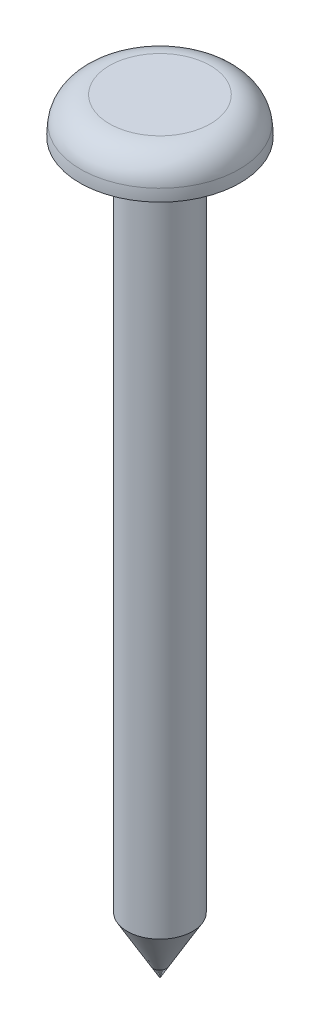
SolidWorks part; units mm, degrees
ref_plane "Plan de face" through (0, 0, 0) normal (0, 0, 1) x (1, 0, 0)
ref_plane "Plan de dessus" through (0, 0, 0) normal (0, 1, 0) x (1, 0, 0)
ref_plane "Plan de droite" through (0, 0, 0) normal (1, 0, 0) x (0, 0, -1)
sketch "Esquisse1" plane through (0, 0, 0) normal (0, 0, 1) x (1, 0, 0)
  line L0 (0, 0) -> (0, -20) construction
  line L1 (-0.9, 0) -> (-0.9, -18.4412)
  line L2 (-0.9, -18.4412) -> (0, -20)
  line L3 (-0.9, 0) -> (-2.2, 0)
  line L4 (0, 0) -> (0, 2) construction
  line L5 (0, 1) -> (-1.3856, 1)
  line L6 (0, 1) -> (0, -20)
  arc A0 (-1.3856, 1) -> (-2.1774, 0.3143) centre (-1.3856, 0.2) ccw
  arc A1 (-2.1774, 0.3143) -> (-2.2, 0) centre (0, 0) ccw
  dimension "D4" = 2.2
  dimension "D6" = 0.8
  dimension "D1" = 30
  dimension "D2" = 1.8
  dimension "D3" = 20
  dimension "D5" = 1
revolve "Révolution1" add sketch "Esquisse1" angle 360 about L6
